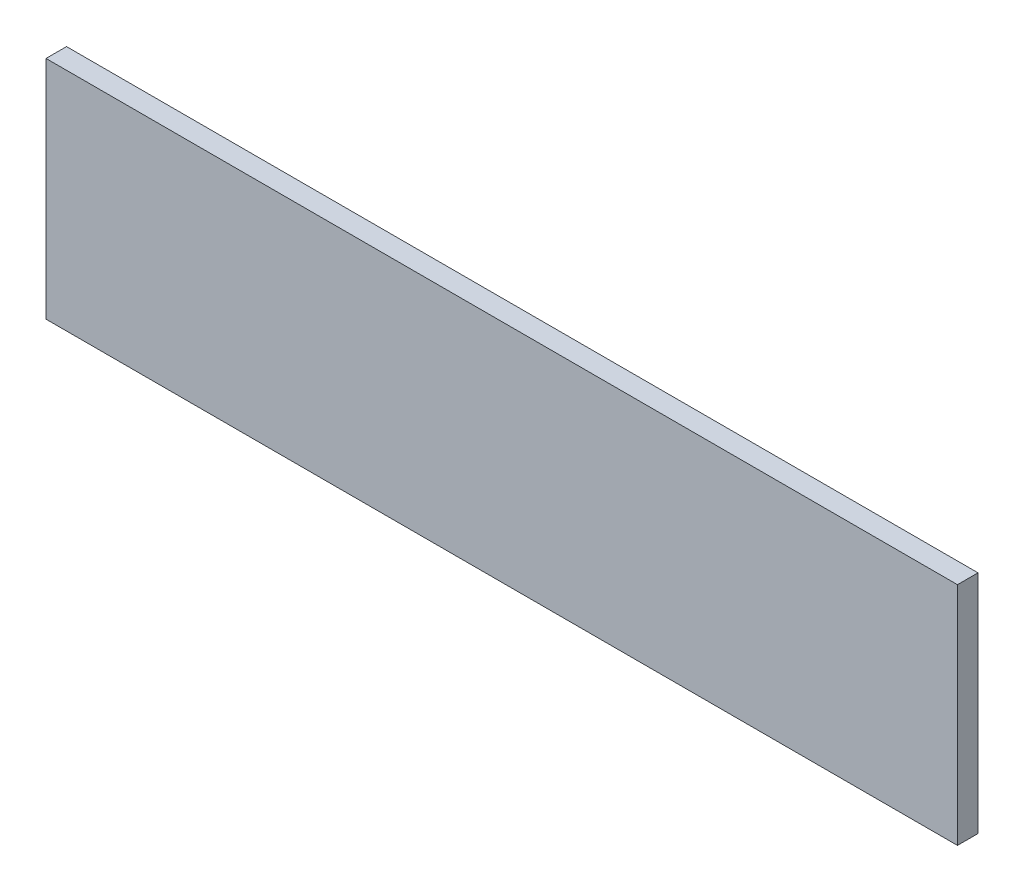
SolidWorks part; units mm, degrees
ref_plane "Vorne" through (0, 0, 0) normal (0, 0, 1) x (1, 0, 0)
ref_plane "Oben" through (0, 0, 0) normal (0, 1, 0) x (1, 0, 0)
ref_plane "Rechts" through (0, 0, 0) normal (1, 0, 0) x (0, 0, -1)
sketch "Skizze2" plane through (0, 0, 0) normal (0, 0, 1) x (1, 0, 0)
  line L0 (2.75, 0) -> (-2.75, 0) construction
  line L1 (-222, 55) -> (0, 55)
  line L2 (-222, 55) -> (-222, 0)
  line L3 (-222, 0) -> (0, 0)
  line L4 (0, 55) -> (0, 0)
  line L5 (0, 2.75) -> (0, -2.75) construction
  line L6 (-222, 2.75) -> (-222, -2.75) construction
  dimension "D1" = 55
extrude "Linear austragen1" add sketch "Skizze2" along normal blind 5
